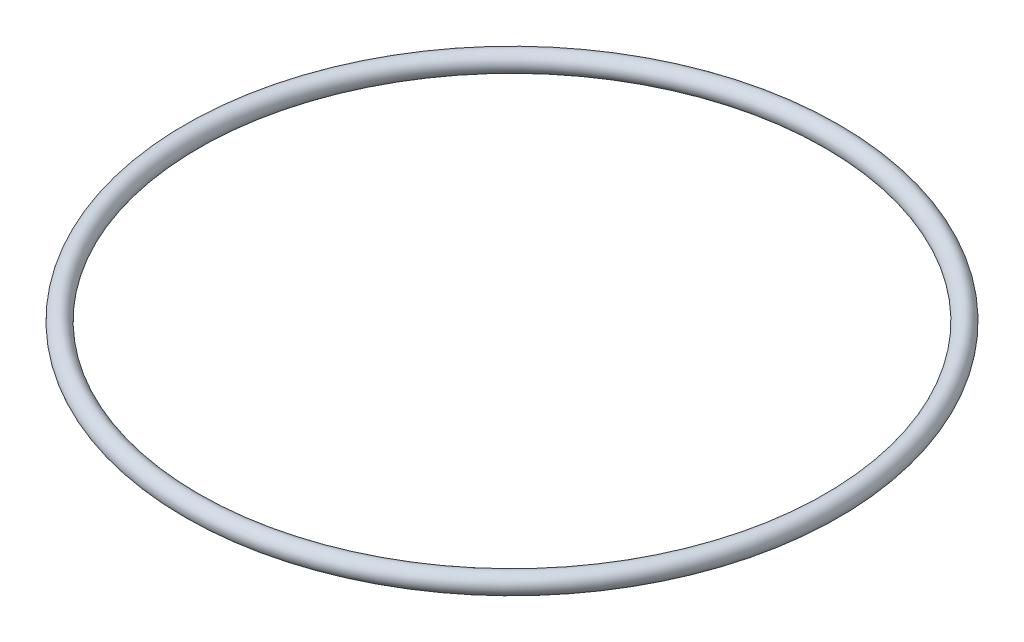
SolidWorks part; units mm, degrees
ref_plane "Front Plane" through (0, 0, 0) normal (0, 0, 1) x (1, 0, 0)
ref_plane "Top Plane" through (0, 0, 0) normal (0, 1, 0) x (1, 0, 0)
ref_plane "Right Plane" through (0, 0, 0) normal (1, 0, 0) x (0, 0, -1)
sketch "Sketch3" plane through (0, 0, 0) normal (1, 0, 0) x (0, 0, -1)
  circle A0 centre (-50.8, 0) radius 1.524
  dimension "D1" = 3.048
  dimension "2" = 50.8
sketch "Sketch4" plane through (0, 0, 0) normal (0, 1, 0) x (1, 0, 0)
  circle A10 centre (0, 0) radius 50.8
sweep "Sweep2" add profiles "Sketch3" path "Sketch4"
ref_plane "Plane1" through (0, 0, 0) normal (1, 0, 0) x (0, 0, -1)
ref_plane "Plane2" through (0, 0, 4) normal (0, 0, 1) x (1, 0, 0)
ref_plane "Plane3" through (0, 0, 0) normal (0, 1, 0) x (1, 0, 0)
ref_plane "Plane4" through (-130, 0, 0) normal (1, 0, 0) x (0, 0, -1)
